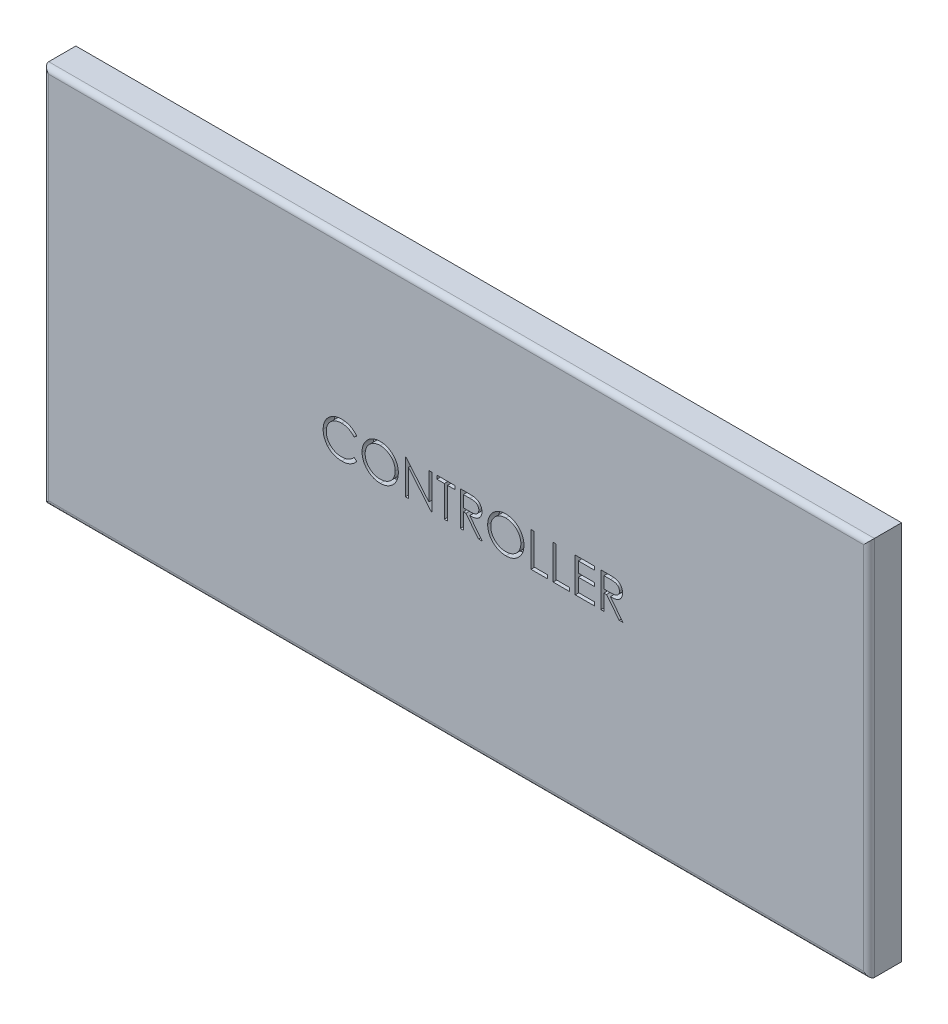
SolidWorks part; units mm, degrees
ref_plane "Front Plane" through (0, 0, 0) normal (0, 0, 1) x (1, 0, 0)
ref_plane "Top Plane" through (0, 0, 0) normal (0, 1, 0) x (1, 0, 0)
ref_plane "Right Plane" through (0, 0, 0) normal (1, 0, 0) x (0, 0, -1)
sketch "Sketch1" plane through (0, 0, 0) normal (0, 0, 1) x (1, 0, 0)
  line L1 (-44.3866, 19.6387) -> (31.6134, 19.6387)
  line L2 (-44.3866, 19.6387) -> (-44.3866, -15.3613)
  line L3 (-44.3866, -15.3613) -> (31.6134, -15.3613)
  line L4 (31.6134, 19.6387) -> (31.6134, -15.3613)
  dimension "D1" = 76
  dimension "D2" = 35
extrude "Boss-Extrude1" add sketch "Sketch1" along normal blind 3
sketch "Sketch2" plane through (0, 0, 3) normal (0, 0, 1) x (1, 0, 0)
  text T0 "CONTROLLER"
extrude "Cut-Extrude1" cut sketch "Sketch2" against normal blind 1
fillet "Fillet1" radius 0.5 4 edges at (31.6134, 2.1387, 3) (-6.3866, -15.3613, 3) (-44.3866, 2.1387, 3) (-6.3866, 19.6387, 3)
